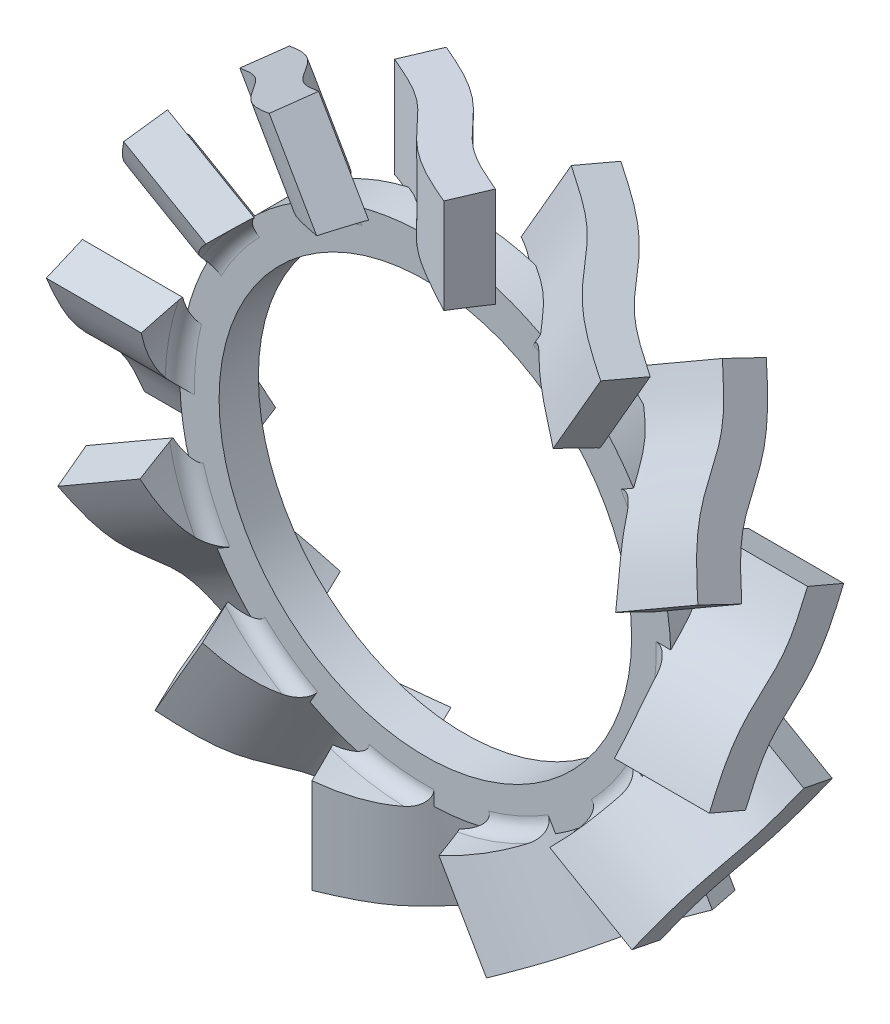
SolidWorks part; units mm, degrees
ref_plane "Plan1" through (0, 0, 0) normal (0, 0, 1) x (1, 0, 0)
ref_plane "Plan2" through (0, 0, 0) normal (0, 1, 0) x (1, 0, 0)
ref_plane "Plan3" through (0, 0, 0) normal (1, 0, 0) x (0, 0, -1)
sketch "Esquisse1" plane through (0, 0, 0) normal (0, 0, 1) x (1, 0, 0)
  circle A0 centre (0, 0) radius 4.2
  circle A1 centre (0, 0) radius 5
  dimension "D1" = 8.4
  dimension "D2" = 10
extrude "Base-Extrusion" add sketch "Esquisse1" along normal blind 0.8
ref_plane "Plan5" through (0, 5, 0) normal (0, 1, 0) x (-1, 0, 0)
sketch "Esquisse3" plane through (0, 5, 0) normal (0, 1, 0) x (-1, 0, 0)
  line L0 (5, 0.8) -> (-5, 0.8) construction
  line L3 (-5, 0) -> (5, 0) construction
  spline_without_curve S0
  dimension "D1" = 1.5
  dimension "D2" = 1.5
  dimension "D3" = 0.4
  dimension "D4" = 0.4
  dimension "D5" = 0.4
  dimension "D6" = 2
  dimension "D7" = 1
extrude "Boss.-Extru.-Mince1" add sketch "Esquisse3" against normal blind 0.3 thin
sketch "Esquisse5" plane through (0, 5, 0) normal (0, 1, 0) x (-1, 0, 0)
  line L2 (1.3428, -0.9678) -> (1.6572, -0.2322)
  line L3 (-1.3428, 1.7678) -> (-1.6572, 1.0322)
  line L4 (1.3428, -0.9678) -> (1.6572, -0.2322)
  line L5 (-1.3428, 1.7678) -> (-1.6572, 1.0322)
  spline S2 degree 3 poles (-1.6572, 1.0322) (-1.3732, 0.9109) (-1.108, 0.7957) (-0.8324, 0.6244) (-0.78, 0.5889) (-0.6809, 0.5145) (-0.6352, 0.4762) (-0.494, 0.3463) (-0.302, 0.1383) (-0.0815, -0.1039) (0.1102, -0.2803) (0.1797, -0.3385) (0.3205, -0.4443) (0.3925, -0.4929) (0.7562, -0.719) (1.0589, -0.8465) (1.3428, -0.9678) knots 0 0 0 0 0.25 0.25 0.3125 0.3125 0.375 0.375 0.5 0.625 0.625 0.6875 0.6875 0.75 0.75 1 1 1 1
  spline S3 degree 3 poles (1.6572, -0.2322) (1.3732, -0.1109) (1.108, 0.0043) (0.8324, 0.1756) (0.78, 0.2111) (0.6809, 0.2855) (0.6352, 0.3238) (0.494, 0.4537) (0.302, 0.6617) (0.0815, 0.9039) (-0.1102, 1.0803) (-0.1797, 1.1385) (-0.3205, 1.2443) (-0.3925, 1.2929) (-0.7562, 1.519) (-1.0589, 1.6465) (-1.3428, 1.7678) knots 0 0 0 0 0.25 0.25 0.3125 0.3125 0.375 0.375 0.5 0.625 0.625 0.6875 0.6875 0.75 0.75 1 1 1 1
  spline S4 degree 3 poles (-1.6572, 1.0322) (-1.3732, 0.9109) (-1.108, 0.7957) (-0.8324, 0.6244) (-0.78, 0.5889) (-0.6809, 0.5145) (-0.6352, 0.4762) (-0.494, 0.3463) (-0.302, 0.1383) (-0.0815, -0.1039) (0.1102, -0.2803) (0.1797, -0.3385) (0.3205, -0.4443) (0.3925, -0.4929) (0.7562, -0.719) (1.0589, -0.8465) (1.3428, -0.9678) knots 0 0 0 0 0.25 0.25 0.3125 0.3125 0.375 0.375 0.5 0.625 0.625 0.6875 0.6875 0.75 0.75 1 1 1 1
  spline S5 degree 3 poles (1.6572, -0.2322) (1.3732, -0.1109) (1.108, 0.0043) (0.8324, 0.1756) (0.78, 0.2111) (0.6809, 0.2855) (0.6352, 0.3238) (0.494, 0.4537) (0.302, 0.6617) (0.0815, 0.9039) (-0.1102, 1.0803) (-0.1797, 1.1385) (-0.3205, 1.2443) (-0.3925, 1.2929) (-0.7562, 1.519) (-1.0589, 1.6465) (-1.3428, 1.7678) knots 0 0 0 0 0.25 0.25 0.3125 0.3125 0.375 0.375 0.5 0.625 0.625 0.6875 0.6875 0.75 0.75 1 1 1 1
  dimension "D1" = 0
extrude "Boss.-Extru.1" add sketch "Esquisse5" along normal blind 1.75
pattern_circular "Répétition circulaire2" count 12 every 30
sketch "Esquisse6" plane through (0, 0, 0) normal (0, 0, -1) x (-1, 0, 0)
  circle A0 centre (0, 0) radius 5
  arc A1 (-2.3468, -4.415) -> (-1.1429, -4.8676) centre (0, 0) ccw construction
extrude "Enlèv. mat.-Extru.1" cut sketch "Esquisse6" along normal through all
sketch "Esquisse7" plane through (0, 0, 0.8) normal (0, 0, 1) x (1, 0, 0)
  arc A24 (0.1751, 4.9969) -> (-1.1429, 4.8676) centre (0, 0) ccw
  arc A25 (1.4441, 4.7869) -> (0.1751, 4.9969) centre (0, 0) ccw
  arc A26 (2.6501, 4.2399) -> (1.4441, 4.7869) centre (0, 0) ccw
  arc A27 (3.6441, 3.4236) -> (2.6501, 4.2399) centre (0, 0) ccw
  arc A28 (4.415, 2.3468) -> (3.6441, 3.4236) centre (0, 0) ccw
  arc A29 (4.8676, 1.1429) -> (4.415, 2.3468) centre (0, 0) ccw
  arc A30 (4.9969, -0.1751) -> (4.8676, 1.1429) centre (0, 0) ccw
  arc A31 (4.7869, -1.4441) -> (4.9969, -0.1751) centre (0, 0) ccw
  arc A32 (4.2399, -2.6501) -> (4.7869, -1.4441) centre (0, 0) ccw
  arc A33 (3.4236, -3.6441) -> (4.2399, -2.6501) centre (0, 0) ccw
  arc A34 (2.3468, -4.415) -> (3.4236, -3.6441) centre (0, 0) ccw
  arc A35 (1.1429, -4.8676) -> (2.3468, -4.415) centre (0, 0) ccw
  arc A36 (-0.1751, -4.9969) -> (1.1429, -4.8676) centre (0, 0) ccw
  arc A37 (-1.4441, -4.7869) -> (-0.1751, -4.9969) centre (0, 0) ccw
  arc A38 (-2.6501, -4.2399) -> (-1.4441, -4.7869) centre (0, 0) ccw
  arc A39 (-3.6441, -3.4236) -> (-2.6501, -4.2399) centre (0, 0) ccw
  arc A40 (-4.415, -2.3468) -> (-3.6441, -3.4236) centre (0, 0) ccw
  arc A41 (-4.8676, -1.1429) -> (-4.415, -2.3468) centre (0, 0) ccw
  arc A42 (-4.9969, 0.1751) -> (-4.8676, -1.1429) centre (0, 0) ccw
  arc A43 (-4.7869, 1.4441) -> (-4.9969, 0.1751) centre (0, 0) ccw
  arc A44 (-4.2399, 2.6501) -> (-4.7869, 1.4441) centre (0, 0) ccw
  arc A45 (-3.4236, 3.6441) -> (-4.2399, 2.6501) centre (0, 0) ccw
  arc A46 (-2.3468, 4.415) -> (-3.4236, 3.6441) centre (0, 0) ccw
  arc A47 (-1.1429, 4.8676) -> (-2.3468, 4.415) centre (0, 0) ccw
  arc A48 (0.1751, 4.9969) -> (-1.1429, 4.8676) centre (0, 0) ccw
  arc A49 (1.4441, 4.7869) -> (0.1751, 4.9969) centre (0, 0) ccw
  arc A50 (2.6501, 4.2399) -> (1.4441, 4.7869) centre (0, 0) ccw
  arc A51 (3.6441, 3.4236) -> (2.6501, 4.2399) centre (0, 0) ccw
  arc A52 (4.415, 2.3468) -> (3.6441, 3.4236) centre (0, 0) ccw
  arc A53 (4.8676, 1.1429) -> (4.415, 2.3468) centre (0, 0) ccw
  arc A54 (4.9969, -0.1751) -> (4.8676, 1.1429) centre (0, 0) ccw
  arc A55 (4.7869, -1.4441) -> (4.9969, -0.1751) centre (0, 0) ccw
  arc A56 (4.2399, -2.6501) -> (4.7869, -1.4441) centre (0, 0) ccw
  arc A57 (3.4236, -3.6441) -> (4.2399, -2.6501) centre (0, 0) ccw
  arc A58 (2.3468, -4.415) -> (3.4236, -3.6441) centre (0, 0) ccw
  arc A59 (1.1429, -4.8676) -> (2.3468, -4.415) centre (0, 0) ccw
  arc A60 (-0.1751, -4.9969) -> (1.1429, -4.8676) centre (0, 0) ccw
  arc A61 (-1.4441, -4.7869) -> (-0.1751, -4.9969) centre (0, 0) ccw
  arc A62 (-2.6501, -4.2399) -> (-1.4441, -4.7869) centre (0, 0) ccw
  arc A63 (-3.6441, -3.4236) -> (-2.6501, -4.2399) centre (0, 0) ccw
  arc A64 (-4.415, -2.3468) -> (-3.6441, -3.4236) centre (0, 0) ccw
  arc A65 (-4.8676, -1.1429) -> (-4.415, -2.3468) centre (0, 0) ccw
  arc A66 (-4.9969, 0.1751) -> (-4.8676, -1.1429) centre (0, 0) ccw
  arc A67 (-4.7869, 1.4441) -> (-4.9969, 0.1751) centre (0, 0) ccw
  arc A68 (-4.2399, 2.6501) -> (-4.7869, 1.4441) centre (0, 0) ccw
  arc A69 (-3.4236, 3.6441) -> (-4.2399, 2.6501) centre (0, 0) ccw
  arc A70 (-2.3468, 4.415) -> (-3.4236, 3.6441) centre (0, 0) ccw
  arc A71 (-1.1429, 4.8676) -> (-2.3468, 4.415) centre (0, 0) ccw
  dimension "D1" = 0
extrude "Enlèv. mat.-Extru.2" cut sketch "Esquisse7" along normal through all
fillet "Congé1" radius 0.3
